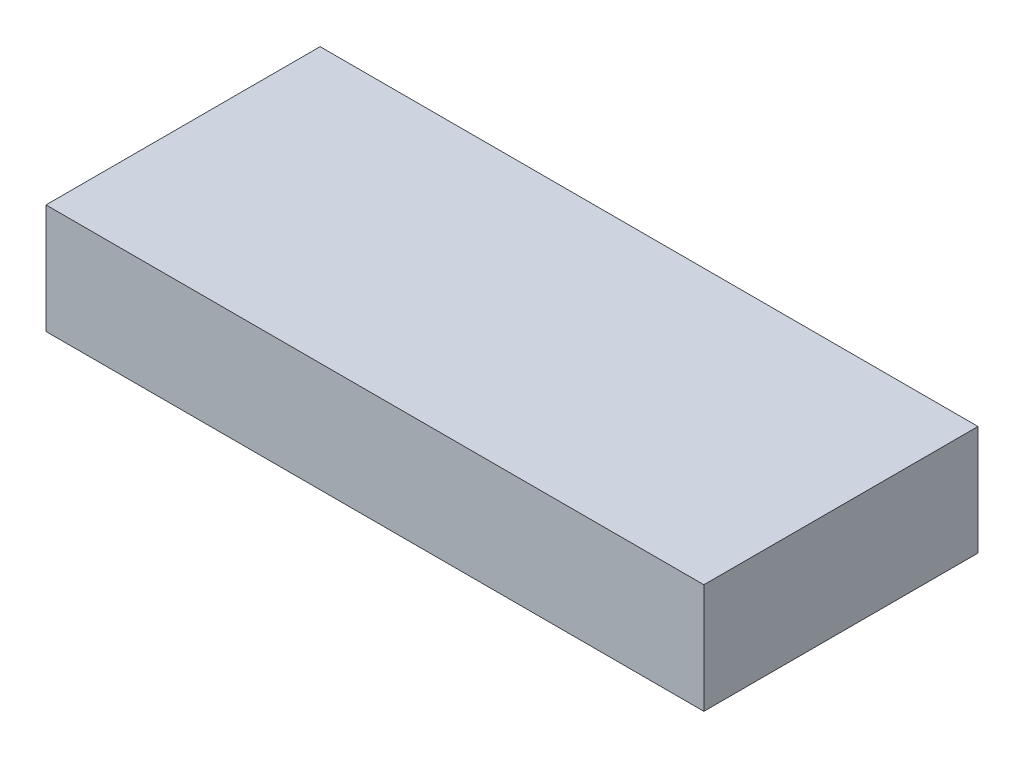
SolidWorks part; units mm, degrees
ref_plane "前视基准面" through (0, 0, 0) normal (0, 0, 1) x (1, 0, 0)
ref_plane "上视基准面" through (0, 0, 0) normal (0, 1, 0) x (1, 0, 0)
ref_plane "右视基准面" through (0, 0, 0) normal (1, 0, 0) x (0, 0, -1)
other "Configuration Table"
sketch "草图1" plane through (0, 0, 0) normal (0, 1, 0) x (1, 0, 0)
  line L1 (-30, 12.5) -> (30, 12.5)
  line L2 (-30, 12.5) -> (-30, -12.5)
  line L3 (-30, -12.5) -> (30, -12.5)
  line L4 (30, 12.5) -> (30, -12.5)
  line L5 (0, -12.5) -> (0, 12.5) construction
  line L6 (-30, 0) -> (30, 0) construction
  point P0 (0, 0)
  dimension "D1" = 60
  dimension "D2" = 25
extrude "凸台-拉伸1" add sketch "草图1" along normal blind 10
